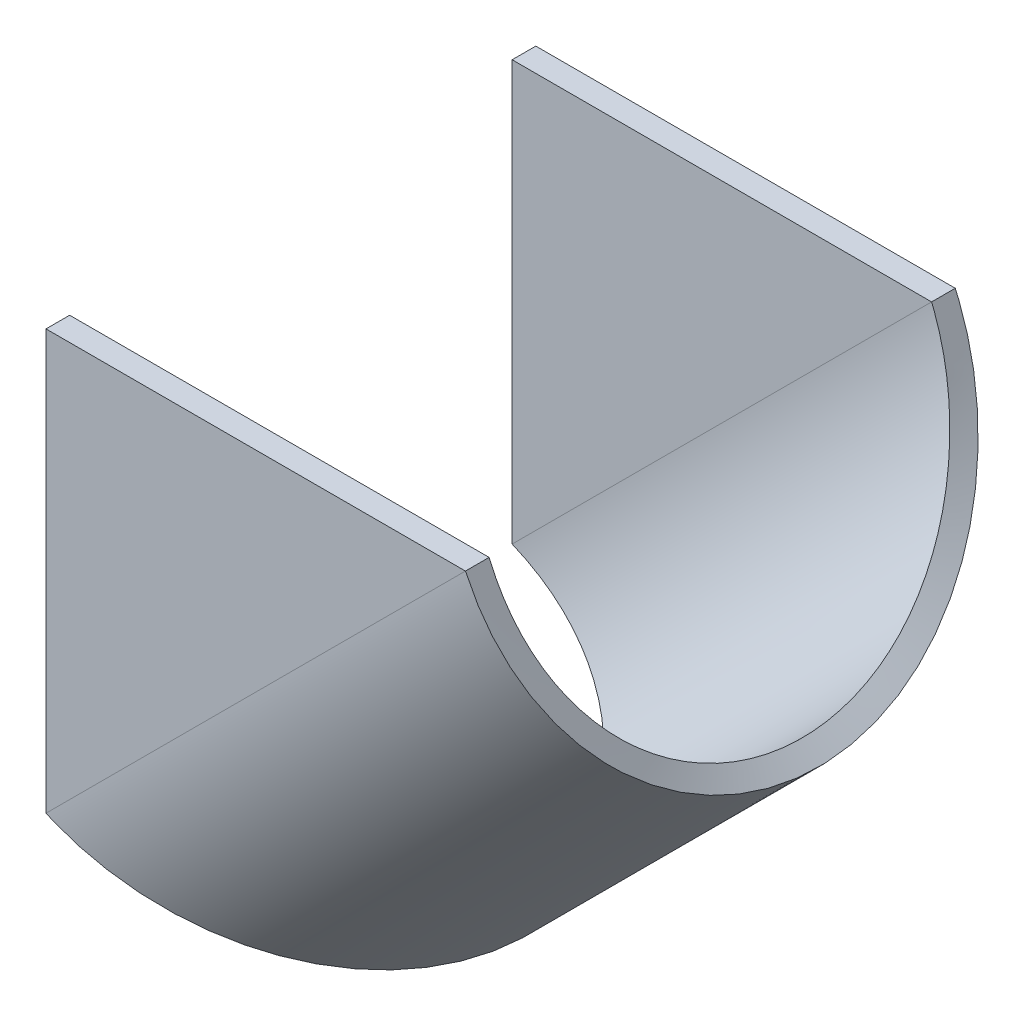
SolidWorks part; units mm, degrees
ref_plane "前视基准面" through (0, 0, 0) normal (0, 0, 1) x (1, 0, 0)
ref_plane "上视基准面" through (0, 0, 0) normal (0, 1, 0) x (1, 0, 0)
ref_plane "右视基准面" through (0, 0, 0) normal (1, 0, 0) x (0, 0, -1)
imported_body "基体零件-带补料的垂直四通管-1"
sheet metal parameters "钣金1" parameters "D1"=0.7366, "厚度"=1
bend "圆角折弯1" bend radius 9.3514 bend angle 180 parameters "D5"=1
flatten bends "展开-折弯1"
sketch "尖角-草图1" plane through (0, 0, -9.3514) normal (0, 0, 1) x (1, 0, 0)
  line L0 (10.3868, -28.115) -> (28.115, -10.3868) construction
  dimension "D1" = 0
process bends "加工-折弯1" parameters "D1"=0
sketch "平面-草图1" plane through (0, 0, -9.3514) normal (0, 0, 1) x (1, 0, 0)
flat pattern "平板型式1"
sketch "折弯-线1" plane through (0, 0, 0) normal (0, 1, 0) x (-1, 0, 0)
bend of the flat pattern "展开-<圆角折弯1>1"
